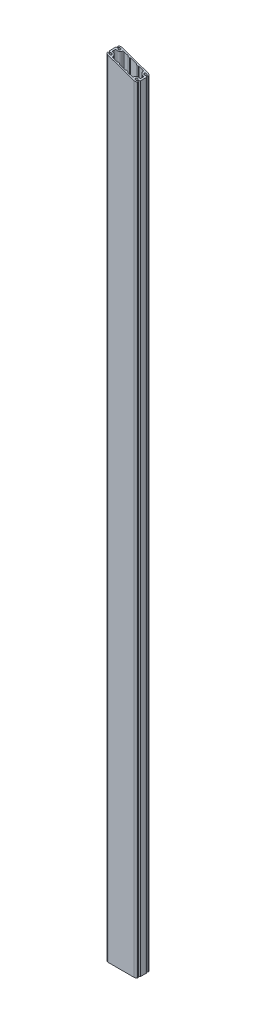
SolidWorks part; units mm, degrees
ref_plane "Alzado" through (0, 0, 0) normal (0, 0, 1) x (1, 0, 0)
ref_plane "Planta" through (0, 0, 0) normal (0, 1, 0) x (1, 0, 0)
ref_plane "Vista lateral" through (0, 0, 0) normal (1, 0, 0) x (0, 0, -1)
sketch "Croquis2" plane through (0, 0, 0) normal (0, 1, 0) x (1, 0, 0)
  line L0 (-183.2758, 0) -> (156.0252, 0) construction
  line L1 (0, 113.0945) -> (0, -113.0945) construction
  line L2 (90, -15.8204) -> (90, 15.8204)
  line L3 (75.5, 40) -> (-75.5, 40)
  line L4 (-17.4827, 32) -> (17.4827, 32)
  line L5 (20, 29) -> (30, 29)
  line L6 (123.5786, 25.5) -> (27.4214, 25.5) construction
  line L7 (75.5, 71.4027) -> (75.5, -20.4027) construction
  line L8 (82, 4.5) -> (82, -4.5)
  line L9 (20, 29) -> (17.4827, 32)
  line L10 (30, 29) -> (32.5173, 32)
  line L11 (32.5173, 32) -> (54.5, 32)
  line L12 (75.5, -71.4027) -> (75.5, 20.4027) construction
  line L13 (123.5786, -25.5) -> (27.4214, -25.5) construction
  line L14 (32.5173, -32) -> (54.5, -32)
  line L15 (30, -29) -> (32.5173, -32)
  line L16 (20, -29) -> (17.4827, -32)
  line L17 (20, -29) -> (30, -29)
  line L18 (-17.4827, -32) -> (17.4827, -32)
  line L19 (75.5, -40) -> (-75.5, -40)
  line L20 (-123.5786, -25.5) -> (-27.4214, -25.5) construction
  line L21 (-75.5, -71.4027) -> (-75.5, 20.4027) construction
  line L22 (-75.5, 71.4027) -> (-75.5, -20.4027) construction
  line L23 (-123.5786, 25.5) -> (-27.4214, 25.5) construction
  line L24 (-20, -29) -> (-30, -29)
  line L25 (-20, -29) -> (-17.4827, -32)
  line L26 (-30, -29) -> (-32.5173, -32)
  line L27 (-32.5173, -32) -> (-54.5, -32)
  line L28 (-32.5173, 32) -> (-54.5, 32)
  line L29 (-30, 29) -> (-32.5173, 32)
  line L30 (-20, 29) -> (-17.4827, 32)
  line L31 (-82, 4.5) -> (-82, -4.5)
  line L32 (-20, 29) -> (-30, 29)
  line L33 (-90, -15.8204) -> (-90, 15.8204)
  arc A0 (88.1963, 32.5039) -> (75.5, 40) centre (75.5, 25.5) ccw
  arc A1 (81.1914, 28.6397) -> (79.722, 20.5579) centre (75.5, 25.5) ccw
  arc A3 (61, 25.5) -> (54.5, 32) centre (54.5, 25.5) ccw
  arc A4 (81.1914, 28.6397) -> (88.1963, 32.5039) centre (84.6939, 30.5718) ccw
  arc A5 (90, 15.8204) -> (79.722, 20.5579) centre (83.7692, 15.8204) ccw
  arc A6 (82, 4.5) -> (75.5, 11) centre (75.5, 4.5) ccw
  arc A7 (61, 25.5) -> (75.5, 11) centre (75.5, 25.5) ccw
  arc A8 (61, -25.5) -> (75.5, -11) centre (75.5, -25.5) cw
  arc A9 (82, -4.5) -> (75.5, -11) centre (75.5, -4.5) cw
  arc A10 (90, -15.8204) -> (79.722, -20.5579) centre (83.7692, -15.8204) cw
  arc A11 (81.1914, -28.6397) -> (88.1963, -32.5039) centre (84.6939, -30.5718) cw
  arc A12 (61, -25.5) -> (54.5, -32) centre (54.5, -25.5) cw
  arc A13 (81.1914, -28.6397) -> (79.722, -20.5579) centre (75.5, -25.5) cw
  arc A14 (88.1963, -32.5039) -> (75.5, -40) centre (75.5, -25.5) cw
  arc A15 (-88.1963, -32.5039) -> (-75.5, -40) centre (-75.5, -25.5) ccw
  arc A16 (-81.1914, -28.6397) -> (-79.722, -20.5579) centre (-75.5, -25.5) ccw
  arc A17 (-61, -25.5) -> (-54.5, -32) centre (-54.5, -25.5) ccw
  arc A18 (-81.1914, -28.6397) -> (-88.1963, -32.5039) centre (-84.6939, -30.5718) ccw
  arc A19 (-90, -15.8204) -> (-79.722, -20.5579) centre (-83.7692, -15.8204) ccw
  arc A20 (-82, -4.5) -> (-75.5, -11) centre (-75.5, -4.5) ccw
  arc A21 (-61, -25.5) -> (-75.5, -11) centre (-75.5, -25.5) ccw
  arc A22 (-61, 25.5) -> (-75.5, 11) centre (-75.5, 25.5) cw
  arc A23 (-82, 4.5) -> (-75.5, 11) centre (-75.5, 4.5) cw
  arc A24 (-90, 15.8204) -> (-79.722, 20.5579) centre (-83.7692, 15.8204) cw
  arc A25 (-81.1914, 28.6397) -> (-88.1963, 32.5039) centre (-84.6939, 30.5718) cw
  arc A26 (-61, 25.5) -> (-54.5, 32) centre (-54.5, 25.5) cw
  arc A27 (-81.1914, 28.6397) -> (-79.722, 20.5579) centre (-75.5, 25.5) cw
  arc A28 (-88.1963, 32.5039) -> (-75.5, 40) centre (-75.5, 25.5) cw
  point P6 (0, 0)
  point P8 (-90, 0)
  point P9 (0, 40)
  point P17 (75.5, 25.5)
  point P20 (75.5, 25.5)
  point P56 (82, 0)
  point P58 (90, 0)
  point P94 (0, -40)
  point P95 (0, -32)
  point P102 (0, 32)
  point P103 (-82, 0)
  dimension "D5" = 14.5
  dimension "D6" = 6.5
  dimension "D7" = 6.2308
  dimension "D8" = 9.1939
  dimension "D1" = 90
  dimension "D2" = 40
  dimension "D3" = 8
  dimension "D4" = 8
  dimension "D9" = 21
  dimension "D10" = 10
  dimension "D11" = 20
  dimension "D12" = 3
  dimension "D13" = 50
  dimension "D14" = 50
extrude "Saliente-Extruir1" add sketch "Croquis2" along normal blind 4584.8
sketch "Croquis3" plane through (0, 0, 40) normal (0, 0, 1) x (1, 0, 0)
  line L0 (90, 4522.4) -> (375.8161, 4522.4) construction
  line L1 (90, 4584.8) -> (90, 0) construction
  line L2 (90, 4522.4) -> (-344.3635, 4672.9793) construction
  line L3 (-90, 4584.8) -> (90, 4584.8) construction
  line L4 (-90, 4584.8) -> (90, 4584.8)
  line L5 (90, 4584.8) -> (90, 4522.4)
  line L6 (90, 4522.4) -> (-90, 4584.8)
  dimension "D1" = 160.88
extrude "Cortar-Extruir1" cut sketch "Croquis3" against normal through all
